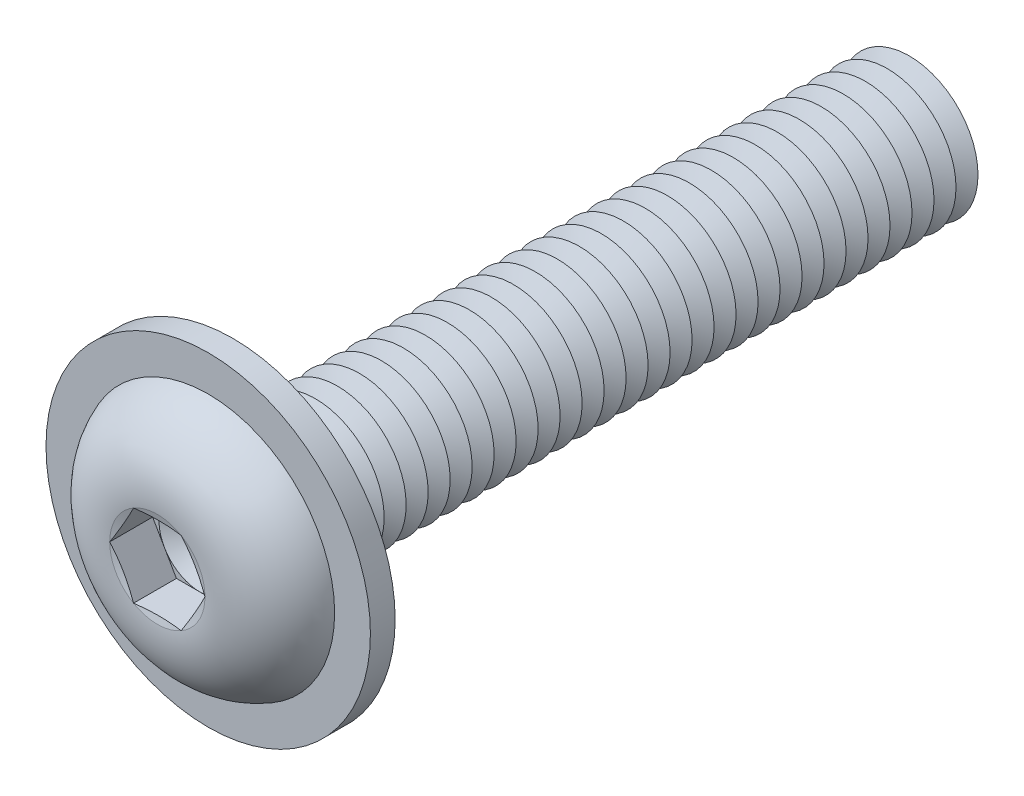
SolidWorks part; units mm, degrees
ref_plane "Front Plane" through (0, 0, 0) normal (0, 0, 1) x (1, 0, 0)
ref_plane "Top Plane" through (0, 0, 0) normal (0, 1, 0) x (1, 0, 0)
ref_plane "Right Plane" through (0, 0, 0) normal (1, 0, 0) x (0, 0, -1)
sketch "Sketch1" plane through (0, 0, 0) normal (1, 0, 0) x (0, 0, -1)
  line L0 (0, 2.5) -> (0, 4.75)
  line L3 (0, 2.5) -> (25, 2.5)
  line L4 (25, 2.5) -> (25, 0)
  line L5 (25, 0) -> (-2.75, 0) construction
  line L6 (-2.75, 0) -> (25, 0)
  line L7 (-2.75, 1.732) -> (-2.75, 0.866) construction
  line L8 (-2.75, 0.866) -> (-2.75, 0)
  line L9 (-2.75, 1.732) -> (-2.5179, 0.866)
  line L10 (-2.5179, 0.866) -> (-2.75, 0.866)
  line L11 (25, 0) -> (22.7481, 0) construction
  line L12 (0, 4.75) -> (-2.75, 4.75) construction
  arc A1 (0, 4.75) -> (-2.75, 1.732) centre (0, 1.9881) ccw
  point P8 (25, 1.25)
  dimension "D1" = 9.5
  dimension "D2" = 5
  dimension "D3" = 2.75
  dimension "D4" = 3.4641
  dimension "D5" = 25
  dimension "D6" = 15
revolve "Revolve1" add sketch "Sketch1" angle 360 about L5
fillet "Fillet1" radius 0.4 1 edges at (-2.5, 0, 0)
sketch "Sketch2" plane through (0, 0, 0) normal (1, 0, 0) x (0, 0, -1)
  line L0 (24.6, 2.5) -> (25.4, 2.5)
  line L1 (25, 2.5) -> (0.4, 2.5) construction
  line L2 (25.4, 2.5) -> (25, 1.8072)
  line L3 (25, -2.5) -> (25, 2.5) construction
  line L4 (25, 1.8072) -> (24.6, 2.5)
  dimension "D1" = 0.8
revolve "Cut-Revolve1" cut sketch "Sketch2" angle 360 about axis through (0, 0, -25) along (0, 0, -1)
pattern_linear "LPattern1" count 31 spacing 0.8 along (0, 0, 1) of "Cut-Revolve1"
sketch "Sketch3" plane through (0, 0, 2.75) normal (0, 0, 1) x (1, 0, 0)
  line L7 (0.866, 1.5) -> (-0.866, 1.5)
  line L8 (-0.866, 1.5) -> (-1.7321, 0)
  line L9 (-1.7321, 0) -> (-0.866, -1.5)
  line L10 (-0.866, -1.5) -> (0.866, -1.5)
  line L11 (0.866, -1.5) -> (1.732, 0)
  line L12 (1.732, 0) -> (0.866, 1.5)
  circle A0 centre (0, 0) radius 1.5 construction
  circle A3 centre (0, 0) radius 1.7321 construction
extrude "Cut-Extrude1" cut sketch "Sketch3" against normal blind 1.56
sketch "Sketch4" plane through (0, 0, 1.19) normal (0, 0, 1) x (1, 0, 0)
  line L1 (0.866, 1.5) -> (-0.866, 1.5) construction
  circle A0 centre (0, 0) radius 1.5
extrude "Cut-Extrude2" cut sketch "Sketch4" against normal through all draft 60
sketch "Sketch5" plane through (0, 0, 0) normal (0, 0, -1) x (-1, 0, 0)
  circle A0 centre (0, 0) radius 5.9
  circle A1 centre (0, 0) radius 2.9
  circle A2 centre (0, 0) radius 2.9 construction
  dimension "D1" = 11.8
extrude "Boss-Extrude1" add sketch "Sketch5" against normal blind 0.9
